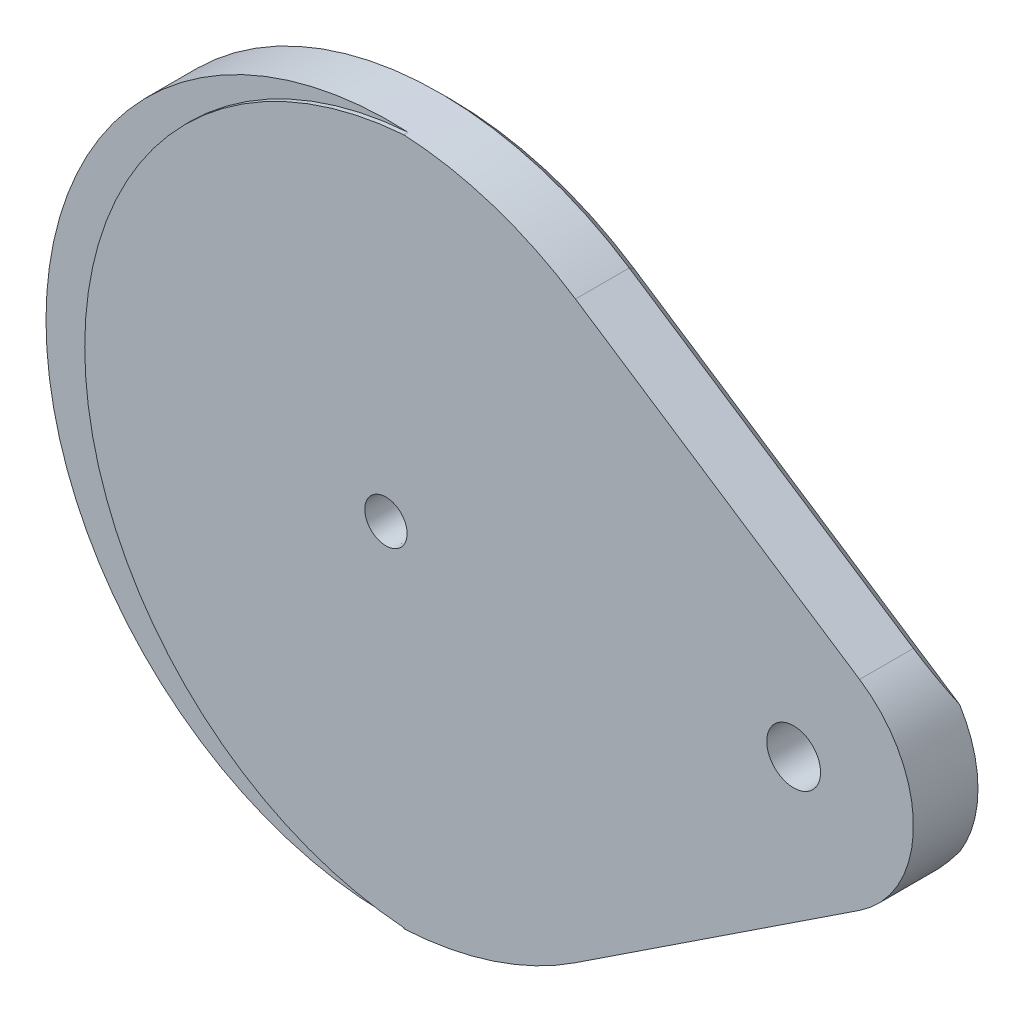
SolidWorks part; units mm, degrees
ref_plane "Plane1" through (0, 0, 0) normal (0, 0, 1) x (1, 0, 0)
ref_plane "Plane2" through (0, 0, 0) normal (0, 1, 0) x (1, 0, 0)
ref_plane "Plane3" through (0, 0, 0) normal (1, 0, 0) x (0, 0, -1)
sketch "Sketch1" plane through (0, 0, 0) normal (0, 0, 1) x (1, 0, 0)
  line L0 (0, 0) -> (120.3198, 0) construction
  line L1 (55.9368, 84.8153) -> (139.7858, 29.5157)
  line L2 (55.9368, -84.8153) -> (139.7858, -29.5157)
  arc A0 (55.9368, 84.8153) -> (55.9368, -84.8153) centre (0, 0) ccw
  arc A1 (139.7858, -29.5157) -> (139.7858, 29.5157) centre (120.3198, 0) ccw
  circle A2 centre (0, 0) radius 5.5562
  circle A3 centre (120.3198, 0) radius 7.9375
  dimension "D1" = 101.6
  dimension "D3" = 35.3568
  dimension "D4" = 15.875
  dimension "D5" = 11.1125
  dimension "D2" = 120.3198
  dimension "D6" = 33.405
extrude "Base-Extrude" add sketch "Sketch1" along normal blind 19.05
sketch "Sketch7" plane through (0, 0, 0) normal (0, 0, -1) x (-1, 0, 0)
  line L1 (-120.3198, -22.225) -> (-120.3198, -29.5157) construction
  line L3 (-123.4948, -19.05) -> (-123.4948, -7.2748)
  line L4 (-123.4948, 19.05) -> (-123.4948, 7.2748)
  line L8 (-123.4948, 7.2748) -> (-123.4948, -7.2748)
  line L9 (-120.3198, 19.05) -> (-120.3198, -22.225)
  line L10 (-120.3198, 19.05) -> (-120.3198, 22.225)
  arc A1 (-120.3198, 22.225) -> (-123.4948, 19.05) centre (-120.3198, 19.05) ccw
  arc A2 (-123.4948, -19.05) -> (-120.3198, -22.225) centre (-120.3198, -19.05) ccw
sketch "Sketch9" plane through (0, 0, 19.05) normal (0, 0, 1) x (1, 0, 0)
  line L0 (0, 0) -> (-128.5975, 0) construction
  line L1 (-101.6, 87.479) -> (-101.6, -104.4189) construction
  line L4 (0, 0) -> (39.2139, 0) construction
  line L5 (5.2733, 101.4606) -> (5.2733, 108.9186)
  line L6 (5.2733, -101.4606) -> (5.2733, -108.9186)
  line L7 (5.2595, -101.1949) -> (5.2733, -101.4606)
  arc A0 (55.9368, 84.8153) -> (55.9368, -84.8153) centre (0, 0) ccw construction
  arc A1 (5.2733, 101.4606) -> (5.2595, -101.1949) centre (12.7, 0.1323) ccw
  arc A2 (5.2733, 108.9186) -> (5.2733, -108.9186) centre (0, 0) ccw
extrude "Cut-Extrude2" cut sketch "Sketch9" against normal blind 1.27
sketch "Sketch11" plane through (0, 0, 0) normal (0, 0, -1) x (-1, 0, 0)
  line L0 (-54.1888, 82.1648) -> (-138.0378, 26.8652)
  line L1 (-138.0378, -26.8652) -> (-54.1888, -82.1648)
  line L2 (-55.9368, -84.8153) -> (-139.7858, -29.5157) construction
  line L3 (-55.9368, 84.8153) -> (-139.7858, 29.5157) construction
  line L5 (-138.0378, 26.8652) -> (-165.3558, 8.8486)
  line L6 (-138.0378, -26.8652) -> (-165.3558, -8.8486)
  line L8 (-165.3558, 8.8486) -> (-180.4454, -1.1032)
  arc A1 (-54.1888, -82.1648) -> (-54.1888, 82.1648) centre (0, 0) ccw
  dimension "D1" = 3.175
  dimension "D2" = 3.175
ref_plane "Plane11" through (139.7858, 29.5157, 0) normal (-0.8348, 0.5506, 0) x (0, 0, 1)
ref_plane "Plane12" through (126.2566, -83.268, 0) normal (-0.8348, 0.5506, 0) x (0, 0, 1)
sketch "Sketch15" plane through (126.2566, -83.268, 0) normal (-0.8348, 0.5506, 0) x (0, 0, 1)
  line L0 (-1.9162, 98.425) -> (0, 98.425)
  line L1 (3.175, 102.5804) -> (3.175, 101.6)
  line L2 (0, 101.6) -> (0, -101.6) construction
  line L3 (19.05, 101.6) -> (0, 101.6) construction
  line L4 (3.175, 101.6) -> (0, 98.425)
  line L5 (-1.9162, 98.425) -> (-1.9162, 102.5804)
  line L6 (-1.9162, 102.5804) -> (3.175, 102.5804)
  dimension "D1" = 3.175
  dimension "D2" = 3.175
sweep "Cut-Sweep4" cut profiles "Sketch15" path "Sketch11"
revolve "Cut-Revolve3" cut sketch "Sketch7" angle 360 about L1
ref_plane "Plane13" through (0, 0, 0) normal (0, 1, 0) x (-1, 0, 0)
sketch "Sketch16" plane through (0, 0, 0) normal (0, 1, 0) x (-1, 0, 0)
  line L0 (0, 0) -> (0, 9.525)
  line L1 (0, 9.525) -> (82.55, 0)
  line L2 (-54.1888, 0) -> (98.425, 0) construction
  line L3 (82.55, 0) -> (0, 0)
  dimension "D1" = 9.525
  dimension "D2" = 82.55
revolve "Cut-Revolve4" cut sketch "Sketch16" angle 360 about L0
hole_wizard "1/4 NPT Tapped Hole1" positions "Sketch18" profile "Sketch17" size "1/4" standard "Ansi Inch"
sketch "Sketch18" plane through (0, 0, 19.05) normal (0, 0, 1) x (1, 0, 0)
  point P0 (0, 0)
sketch "Sketch17" plane through (0, 0, 19.05) normal (1, 0, 0) x (0, -1, 0)
  line L0 (0, 0) -> (0, 20.4365)
  line L1 (5.5626, 17.0942) -> (0, 20.4365)
  line L2 (-5.5626, 17.0942) -> (0, 20.4365) construction
  line L3 (5.5626, 17.0942) -> (5.5626, 10.033)
  line L4 (5.5626, 10.033) -> (5.9437, 10.033)
  line L5 (5.9437, 10.033) -> (6.2441, 0)
  line L6 (-5.9437, 10.033) -> (-6.2441, 0) construction
  line L7 (6.2441, 0) -> (0, 0)
  line L8 (0, -6.35) -> (0, 107.95) construction
  line L11 (-5.5626, 10.033) -> (-5.9437, 10.033) construction
  dimension "Tap Drill Dia." = 11.1252
  dimension "Tap Drill Depth" = 17.0942
  dimension "Thread Dia." = 12.4882
  dimension "Thread Angle" = 3.43
  dimension "Thread Depth" = 10.033
  dimension "Drill Angle" = 118
